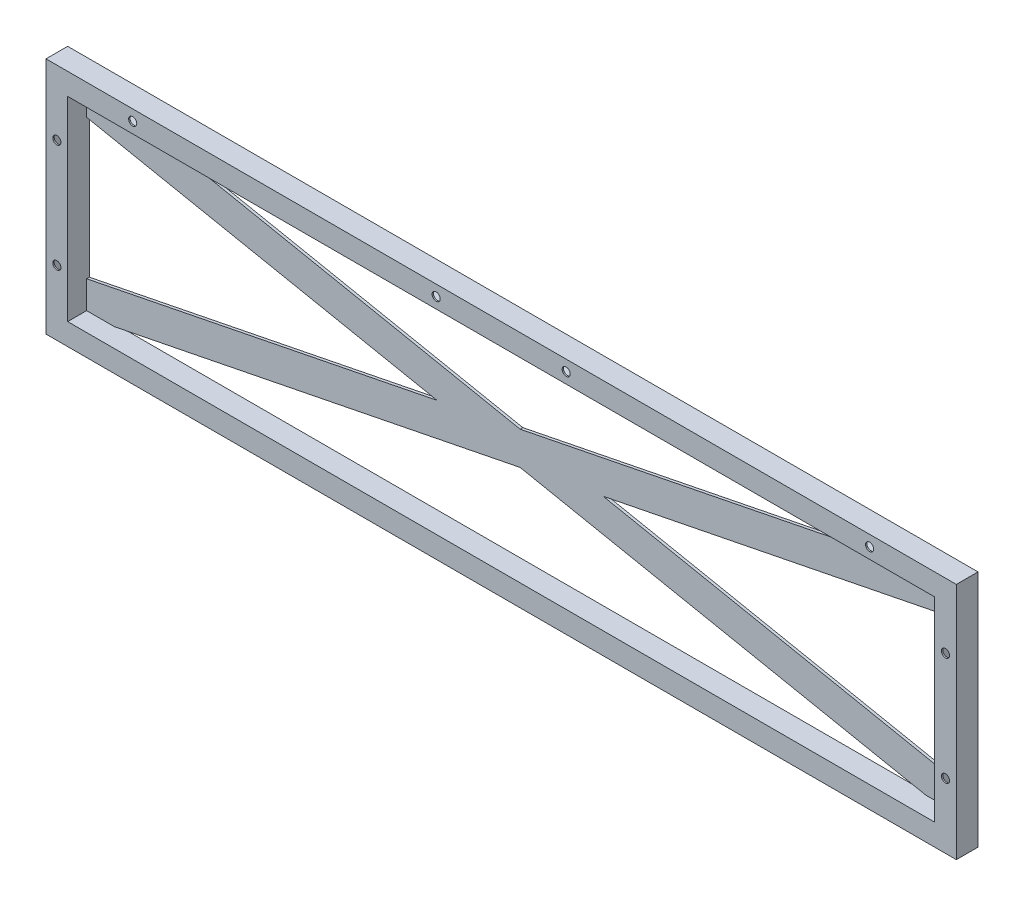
SolidWorks part; units mm, degrees
ref_plane "Front Plane" through (0, 0, 0) normal (0, 0, 1) x (1, 0, 0)
ref_plane "Top Plane" through (0, 0, 0) normal (0, 1, 0) x (1, 0, 0)
ref_plane "Right Plane" through (0, 0, 0) normal (1, 0, 0) x (0, 0, -1)
sketch "Sketch1" plane through (0, 0, 0) normal (0, 0, 1) x (1, 0, 0)
  line L1 (508, -114.3) -> (-508, -114.3)
  line L2 (508, -114.3) -> (508, 114.3)
  line L3 (508, 114.3) -> (-508, 114.3)
  line L4 (-508, -114.3) -> (-508, 114.3)
  line L5 (508, -114.3) -> (-508, 114.3) construction
  line L6 (508, 114.3) -> (-508, -114.3) construction
  line L7 (533.4, -139.7) -> (-533.4, -139.7)
  line L8 (533.4, -139.7) -> (533.4, 139.7)
  line L9 (533.4, 139.7) -> (-533.4, 139.7)
  line L10 (-533.4, -139.7) -> (-533.4, 139.7)
  line L11 (533.4, -139.7) -> (-533.4, 139.7) construction
  line L12 (533.4, 139.7) -> (-533.4, -139.7) construction
  point P0 (0, 0)
  point P6 (0, 0)
  dimension "D1" = 1016
  dimension "D2" = 1066.8
  dimension "9" = 228.6
  dimension "11" = 279.4
extrude "rectangle for panel" add sketch "Sketch1" along normal blind 25.4
shell "shell for hollow interior" thickness 1.5875
sketch "Sketch9" plane through (0, 0, 0) normal (0, 0, -1) x (-1, 0, 0)
  line L0 (475.6104, 114.3) -> (-508, -81.9104)
  line L2 (-508, 114.3) -> (508, 114.3) construction
  line L5 (-508, -114.3) -> (-508, 114.3) construction
  line L6 (475.6104, 114.3) -> (508, 114.3)
  line L7 (508, 114.3) -> (508, 81.9104)
  line L8 (508, 114.3) -> (508, -114.3) construction
  line L9 (508, 81.9104) -> (-475.6104, -114.3)
  line L10 (508, -114.3) -> (-508, -114.3) construction
  line L11 (-508, -81.9104) -> (-508, -114.3)
  line L12 (-508, -114.3) -> (-475.6104, -114.3)
  dimension "D1" = 38.1
extrude "diagonal extrude" add sketch "Sketch9" against normal blind 3.175
mirror "diagonal mirror" about plane through (0, 0, 0) normal (1, 0, 0) of "diagonal extrude"
ref_plane "Plane1" through (-533.4, 139.7, 25.4) normal (-1, 0, 0) x (0, 0, 1)
sketch "Sketch5" plane through (0, 0, 0) normal (0, 0, 1) x (1, 0, 0)
  line L0 (-533.4, 433.07) -> (-533.4, -153.67) construction
  line L1 (533.4, 139.7) -> (-533.4, 139.7) construction
  line L2 (0, 0) -> (0, 251.6999) construction
  line L3 (0, 0) -> (290.1806, 0) construction
  circle A0 centre (-520.7, 63.5) radius 4.7625
  circle A1 centre (-520.7, -63.5) radius 4.7625
  circle A2 centre (520.7, -63.5) radius 4.7625
  circle A3 centre (520.7, 63.5) radius 4.7625
  dimension "D1" = 9.525
  dimension "D2" = 12.7
  dimension "D3" = 76.2
extrude "Cut-Extrude2" cut sketch "Sketch5" along normal blind 25.4
sketch "Sketch11" plane through (0, 0, 25.4) normal (0, 0, 1) x (1, 0, 0)
  line L0 (533.4, -139.7) -> (533.4, 139.7) construction
  line L1 (508, 114.3) -> (-508, 114.3) construction
  circle A0 centre (431.8, 127) radius 4.7625
  circle A1 centre (76.2, 127) radius 4.7625
  dimension "D1" = 9.525
  dimension "D2" = 9.525
  dimension "D3" = 101.6
  dimension "D4" = 457.2
  dimension "D5" = 12.7
  dimension "D6" = 12.7
extrude "Cut-Extrude5" cut sketch "Sketch11" against normal through all
mirror "Mirror2" about plane through (0, 0, 0) normal (1, 0, 0) of "Cut-Extrude5"
